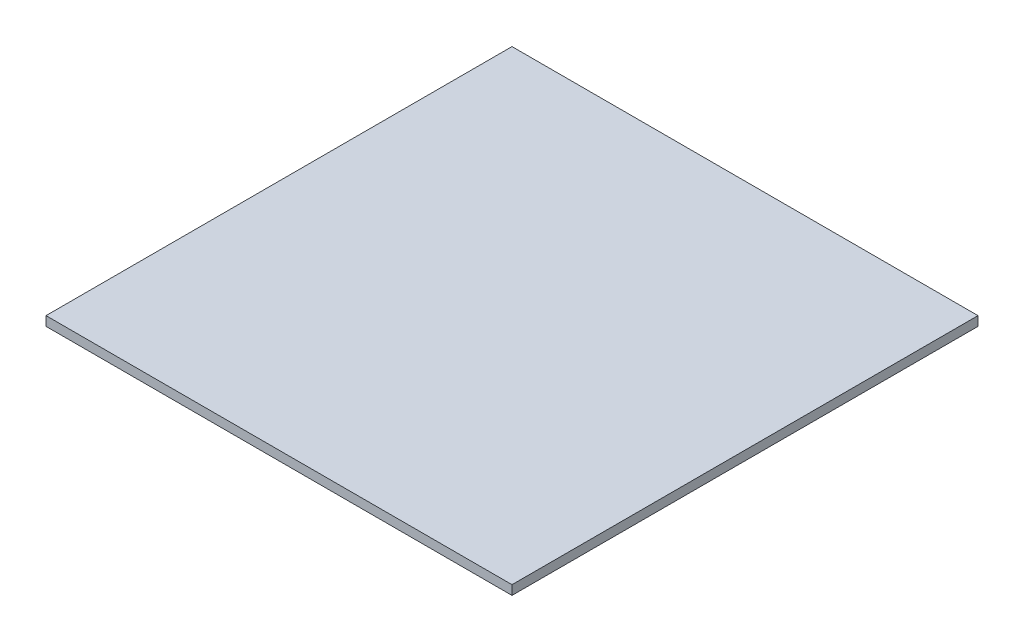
SolidWorks part; units mm, degrees
ref_plane "Front Plane" through (0, 0, 0) normal (0, 0, 1) x (1, 0, 0)
ref_plane "Top Plane" through (0, 0, 0) normal (0, 1, 0) x (1, 0, 0)
ref_plane "Right Plane" through (0, 0, 0) normal (1, 0, 0) x (0, 0, -1)
sketch "Sketch1" plane through (0, 0, 0) normal (0, 1, 0) x (1, 0, 0)
  line L1 (-250, -250) -> (250, -250)
  line L2 (-250, -250) -> (-250, 250)
  line L3 (-250, 250) -> (250, 250)
  line L4 (250, -250) -> (250, 250)
  line L5 (-250, -250) -> (250, 250) construction
  line L6 (-250, 250) -> (250, -250) construction
  point P0 (0, 0)
  dimension "D1" = 500
  dimension "D2" = 500
extrude "Boss-Extrude1" add sketch "Sketch1" along normal blind 10
